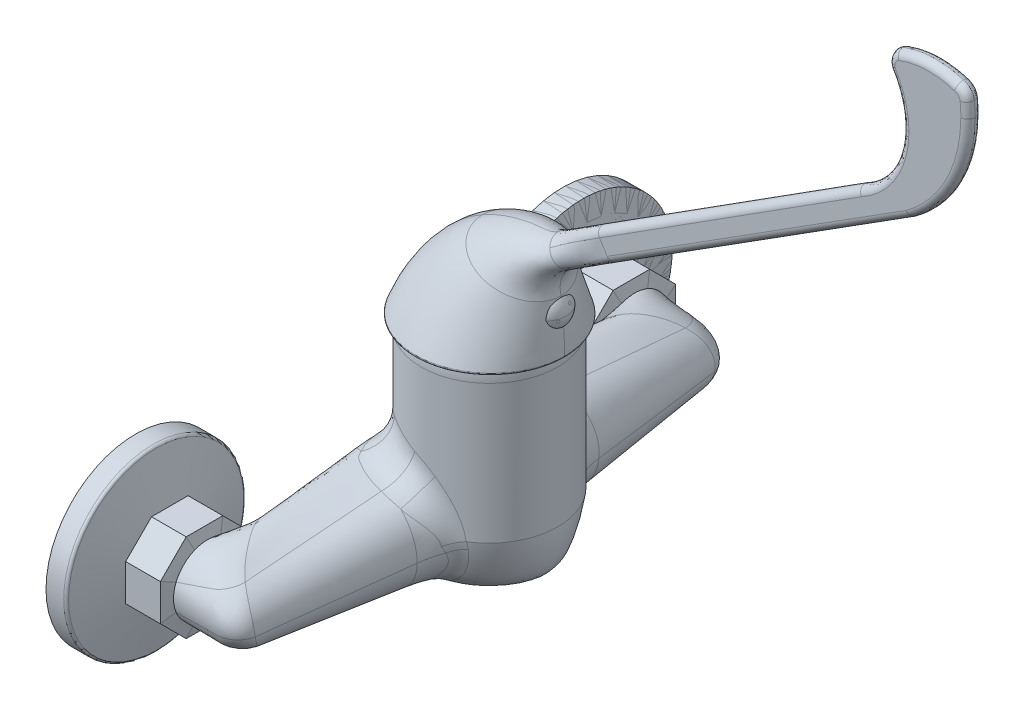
SolidWorks part; units mm, degrees
ref_plane "Front Plane" through (0, 0, 0) normal (0, 0, 1) x (1, 0, 0)
ref_plane "Top Plane" through (0, 0, 0) normal (0, 1, 0) x (1, 0, 0)
ref_plane "Right Plane" through (0, 0, 0) normal (1, 0, 0) x (0, 0, -1)
imported_body "Imported1"
imported_body "Imported2"
fillet "Fillet1" radius 1
fillet "Fillet2" radius 0.5 2 edges at (-3.2606, 86, -26.2609) (1.3892, 86, 26.2494)
